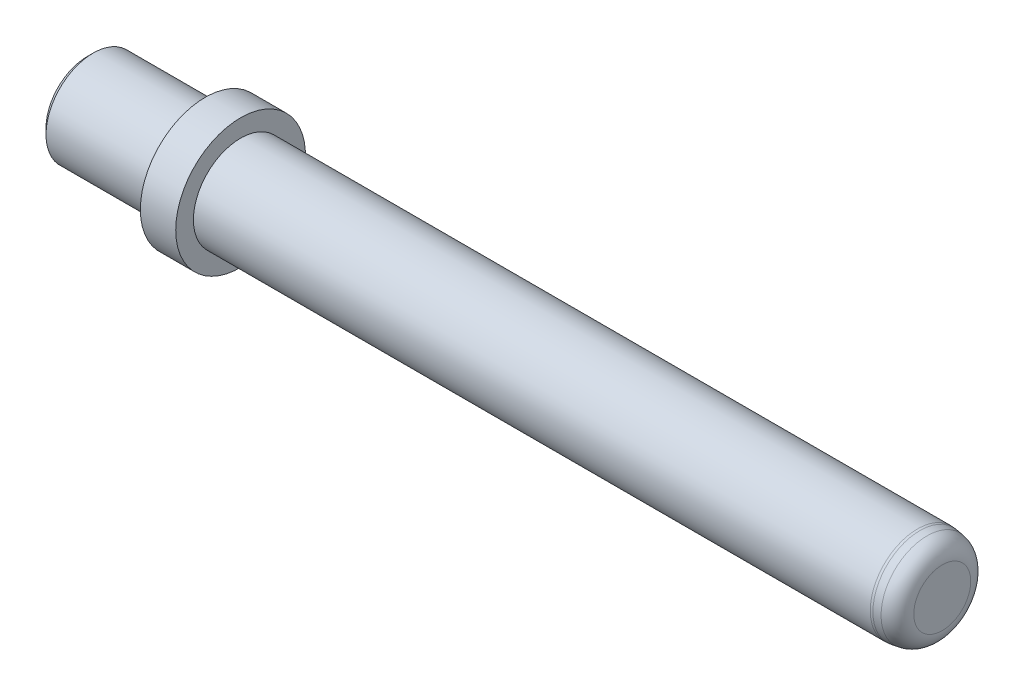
SolidWorks part; units mm, degrees
ref_plane "Plan de face" through (0, 0, 0) normal (0, 0, 1) x (1, 0, 0)
ref_plane "Plan de dessus" through (0, 0, 0) normal (0, 1, 0) x (1, 0, 0)
ref_plane "Plan de droite" through (0, 0, 0) normal (1, 0, 0) x (0, 0, -1)
sketch "Esquisse1" plane through (0, 0, 0) normal (0, 0, 1) x (1, 0, 0)
  line L0 (6.0429, 0) -> (4, 3.4)
  line L1 (4, 3.4) -> (0, 3.4)
  line L2 (0, 3.4) -> (0, 4)
  line L3 (0, 4) -> (-20, 4)
  line L4 (-20, 4) -> (-20, 7)
  line L5 (-20, 7) -> (-19, 8)
  line L6 (-19, 8) -> (0, 8)
  line L7 (0, 8) -> (0, 11)
  line L8 (0, 11) -> (6, 11)
  line L9 (6, 11) -> (6, 8)
  line L10 (6, 8) -> (120.7902, 8)
  line L11 (121.2077, 7.9708) -> (122.4175, 7.8008)
  line L12 (125, 4.83) -> (125, 0)
  line L13 (125, 0) -> (6.0429, 0)
  line L14 (125, 0) -> (6.0429, 0) construction
  arc A0 (120.7902, 8) -> (121.2077, 7.9708) centre (120.7902, 5) cw
  arc A1 (122.4175, 7.8008) -> (125, 4.83) centre (122, 4.83) cw
revolve "Révolution1" add sketch "Esquisse1" angle 360 about L14
ref_plane "Plan1" through (0, 0, 0) normal (-1, 0, 0) x (0, 0, 1)
